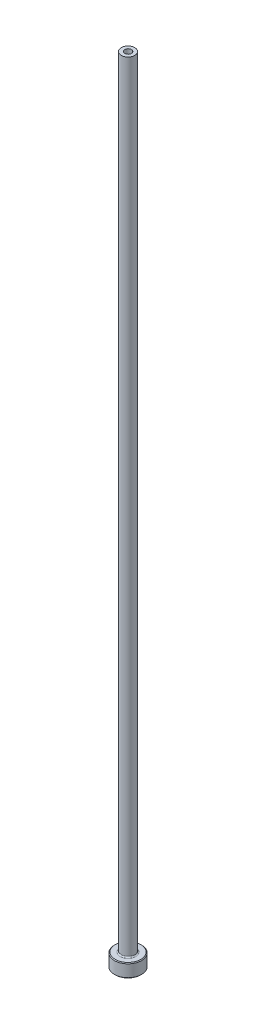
SolidWorks part; units mm, degrees
ref_plane "Front Plane" through (0, 0, 0) normal (0, 0, 1) x (1, 0, 0)
ref_plane "Top Plane" through (0, 0, 0) normal (0, 1, 0) x (1, 0, 0)
ref_plane "Right Plane" through (0, 0, 0) normal (1, 0, 0) x (0, 0, -1)
sketch "Sketch1" plane through (0, 0, 0) normal (0, 0, 1) x (1, 0, 0)
  line L0 (0, 0) -> (0, 50000) construction
  line L1 (0, 0) -> (4.7625, 0)
  line L2 (4.7625, 0) -> (4.7625, 4.7498)
  line L3 (4.7625, 4.7498) -> (2.7718, 4.7498)
  line L4 (2.3749, 5.1467) -> (2.3749, 279.4)
  line L5 (2.3749, 279.4) -> (0, 279.4)
  line L6 (0, 279.4) -> (0, 0)
  arc A0 (2.3749, 5.1467) -> (2.7718, 4.7498) centre (2.7718, 5.1467) ccw
  dimension "D5" = 0.3969
  dimension "D1" = 4.7498
  dimension "D2" = 9.525
  dimension "D3" = 4.7498
  dimension "D4" = 279.4
revolve "Revolve1" add sketch "Sketch1" angle 360 about L0
sketch "Sketch2" plane through (0, 0, 0) normal (0, 0, 1) x (1, 0, 0)
  line L0 (0, 0) -> (0, 50000) construction
  line L1 (-4.7625, 0) -> (4.7625, 0) construction
  line L2 (1.7774, 0) -> (1.3805, 0.3969)
  line L3 (1.3805, 0.3969) -> (1.3805, 217.6145)
  line L4 (1.3805, 217.6145) -> (1.19, 231.902)
  line L5 (1.19, 231.902) -> (1.19, 279.4)
  line L6 (2.3749, 279.4) -> (-2.3749, 279.4) construction
  line L7 (1.19, 279.4) -> (0, 279.4)
  line L8 (0, 279.4) -> (0, 0)
  line L9 (0, 0) -> (1.7774, 0)
  point P4 (0, 0)
  dimension "D1" = 0.3969
  dimension "D2" = 45
  dimension "D3" = 2.38
  dimension "D4" = 2.761
  dimension "D5" = 47.498
  dimension "D6" = 14.2875
revolve "Cut-Revolve1" cut sketch "Sketch2" angle 360 about L0
chamfer "Chamfer1" distance 0.254 angle 45 2 edges at (0, 0, -4.7625) (0, 4.7498, -4.7625)
